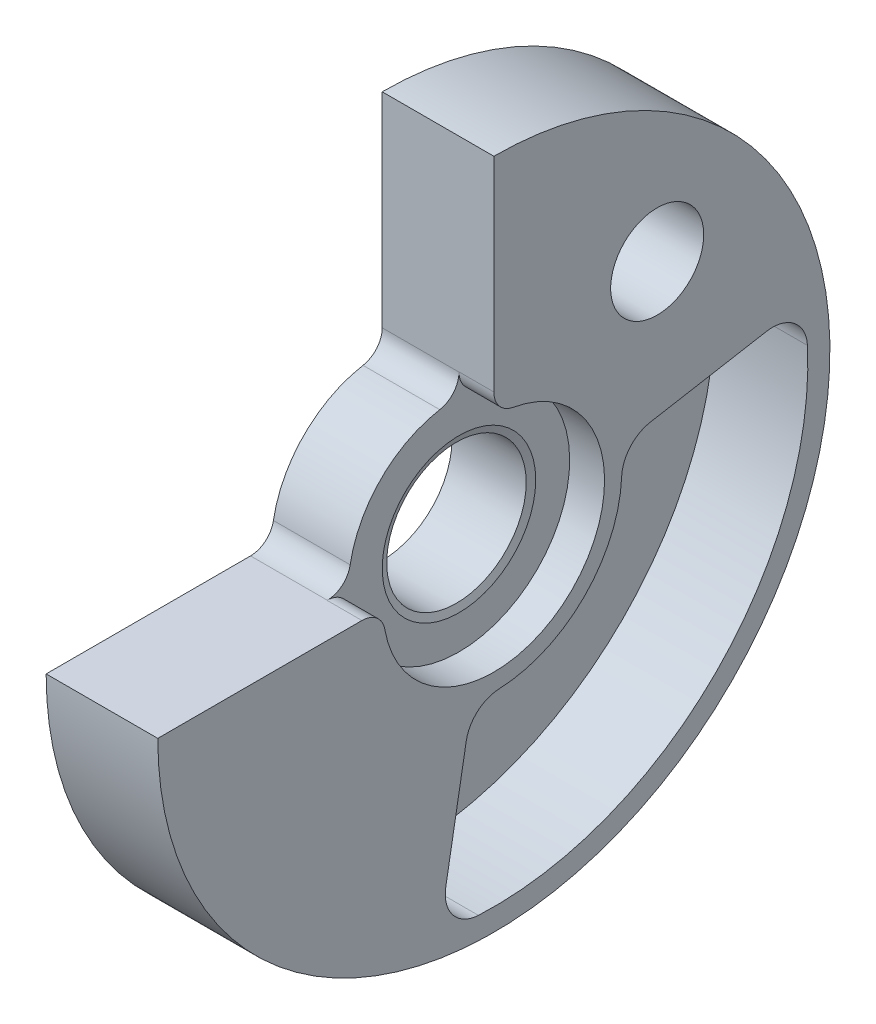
SolidWorks part; units mm, degrees
ref_plane "Front Plane" through (0, 0, 0) normal (0, 0, 1) x (1, 0, 0)
ref_plane "Top Plane" through (0, 0, 0) normal (0, 1, 0) x (1, 0, 0)
ref_plane "Right Plane" through (0, 0, 0) normal (1, 0, 0) x (0, 0, -1)
sketch "Sketch1" plane through (0, 0, 0) normal (1, 0, 0) x (0, 0, -1)
  circle A0 centre (0, 0) radius 14.45
  dimension "D1" = 28.9
extrude "Boss-Extrude1" add sketch "Sketch1" along normal blind 4.8
sketch "Sketch2" plane through (4.8, 0, 0) normal (1, 0, 0) x (0, 0, -1)
  line L0 (0, 4.75) -> (0, 15.2636)
  line L1 (-4.75, 0) -> (-15.2636, 0)
  arc A0 (0, 4.75) -> (-4.75, 0) centre (0, 0) ccw
  arc A1 (0, 15.2636) -> (-15.2636, 0) centre (0, 0) ccw
  point P7 (0, 4.75)
  point P11 (-4.75, 0)
  dimension "D1" = 9.5
extrude "Cut-Extrude1" cut sketch "Sketch2" against normal through all
sketch "Sketch3" plane through (4.8, 0, 0) normal (1, 0, 0) x (0, 0, -1)
  circle A0 centre (0, 0) radius 4.76
  dimension "D1" = 9.52
extrude "Cut-Extrude2" cut sketch "Sketch3" against normal blind 1.5
fillet "Fillet2" radius 1 2 edges at (1.65, 0, 4.75) (1.65, 4.75, 0)
fillet "Fillet3" radius 1 2 edges at (4.05, 0.7011, 4.7081) (4.05, 4.7081, 0.7011)
sketch "Sketch4" plane through (4.8, 0, 0) normal (1, 0, 0) x (0, 0, -1)
  line L0 (0, 0) -> (18.717, 0) construction
  line L1 (0, 0) -> (0, -15.6545) construction
  line L2 (6.7335, 1.1873) -> (11.725, 2.0674)
  line L3 (-1.1873, -6.7335) -> (-2.0674, -11.725)
  arc A0 (0.2278, -5.4953) -> (5.4953, -0.2278) centre (0, 0) ccw
  arc A1 (-0.664, -13.4837) -> (13.4837, 0.664) centre (0, 0) ccw
  arc A2 (-0.664, -13.4837) -> (-2.0674, -11.725) centre (-0.5902, -11.9855) cw
  arc A3 (-1.1873, -6.7335) -> (0.2278, -5.4953) centre (0.2899, -6.994) cw
  arc A4 (13.4837, 0.664) -> (11.725, 2.0674) centre (11.9855, 0.5902) ccw
  arc A5 (6.7335, 1.1873) -> (5.4953, -0.2278) centre (6.994, -0.2899) ccw
  dimension "D1" = 13.5
  dimension "D2" = 5.5
  dimension "D5" = 1.5
  dimension "D3" = 10
  dimension "D4" = 10
extrude "Cut-Extrude3" cut sketch "Sketch4" against normal blind 4
sketch "Sketch5" plane through (3.3, 0, 0) normal (1, 0, 0) x (0, 0, -1)
  circle A0 centre (0, 0) radius 3
  dimension "D1" = 6
extrude "Cut-Extrude4" cut sketch "Sketch5" against normal up to surface (3.3 mm away)
chamfer "Chamfer1" distance 0.3 angle 20 1 edges at (3.3, 0, -3)
sketch "Sketch6" plane through (4.8, 0, 0) normal (1, 0, 0) x (0, 0, -1)
  line L0 (0, 0) -> (0, 15.9558) construction
  line L1 (0, 0) -> (7.0216, 7.0216) construction
  circle A0 centre (7.0216, 7.0216) radius 2
  dimension "D1" = 4
  dimension "D4" = 45
  dimension "D2" = 9.93
extrude "Cut-Extrude6" cut sketch "Sketch6" against normal through all contours A0
